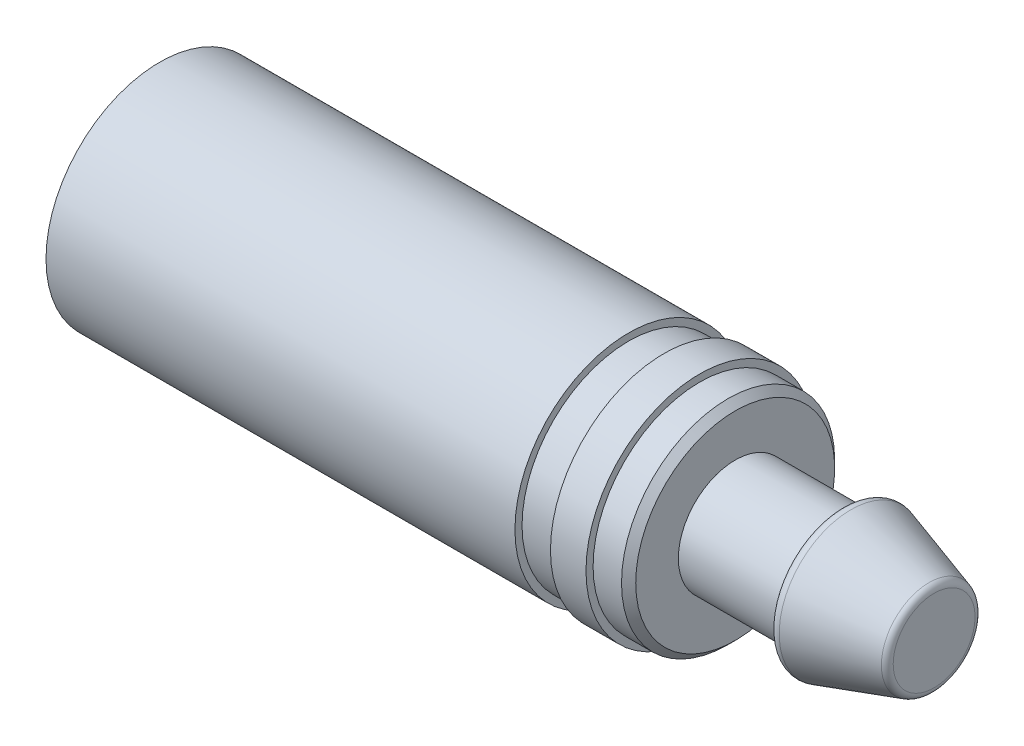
SolidWorks part; units mm, degrees
ref_plane "Alzado" through (0, 0, 0) normal (0, 0, 1) x (1, 0, 0)
ref_plane "Planta" through (0, 0, 0) normal (0, 1, 0) x (1, 0, 0)
ref_plane "Vista lateral" through (0, 0, 0) normal (1, 0, 0) x (0, 0, -1)
sketch "Croquis1" plane through (0, 0, 0) normal (0, 0, 1) x (1, 0, 0)
  line L0 (0, 0) -> (36.1529, 0) construction
  line L1 (0, 0) -> (0, 16)
  line L2 (0, 16) -> (66, 16)
  line L3 (66, 16) -> (66, 15)
  line L4 (66, 15) -> (71, 15)
  line L5 (71, 15) -> (71, 16)
  line L6 (71, 16) -> (76, 16)
  line L7 (76, 16) -> (76, 15)
  line L8 (76, 15) -> (81, 15)
  line L9 (81, 15) -> (81, 8)
  line L10 (81, 8) -> (96, 8)
  line L11 (96, 8) -> (96, 10.5)
  line L12 (96, 10.5) -> (109, 6.5)
  line L15 (0, 0) -> (109, 0)
  line L16 (109, 0) -> (109, 6.5)
  dimension "D1" = 32
  dimension "D2" = 66
  dimension "D3" = 1
  dimension "D4" = 5
  dimension "D5" = 5
  dimension "D6" = 5
  dimension "D7" = 16
  dimension "D8" = 15
  dimension "D9" = 13
  dimension "D10" = 28
  dimension "D11" = 21
revolve "Revolución1" add sketch "Croquis1" angle 360 about L0
fillet "Redondeo1" radius 1 2 edges at (109, 0, 6.5) (96, 0, 10.5)
chamfer "Chaflán1" distance 1 angle 45 1 edges at (81, 0, 15)
